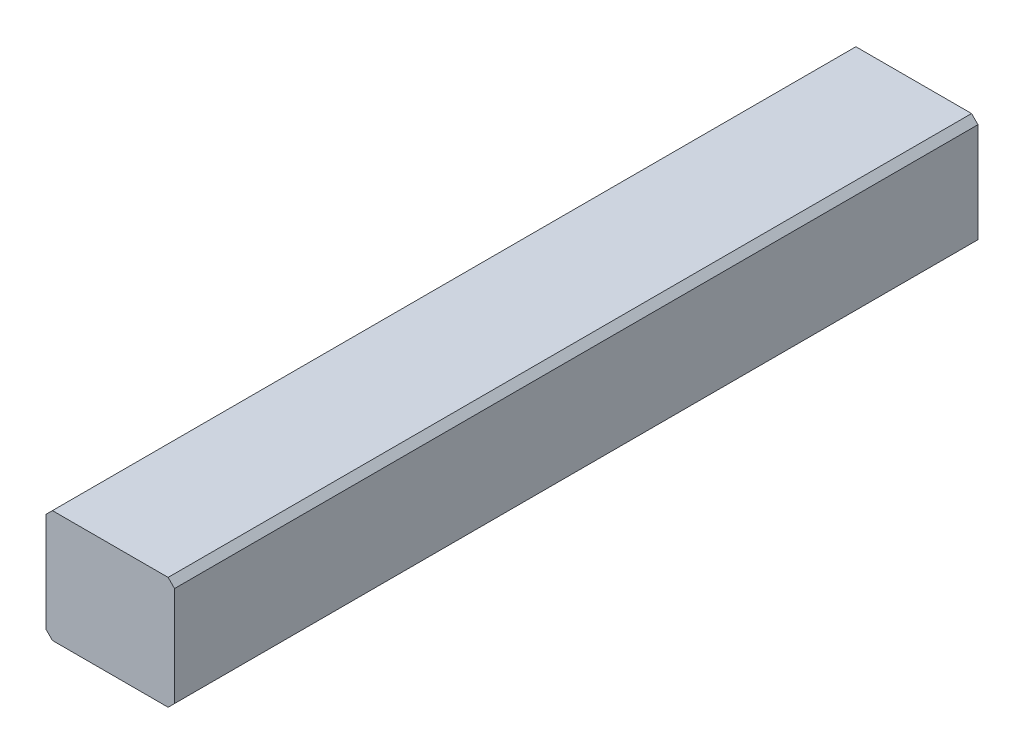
SolidWorks part; units mm, degrees
ref_plane "Front" through (0, 0, 0) normal (0, 0, 1) x (1, 0, 0)
ref_plane "Top" through (0, 0, 0) normal (0, 1, 0) x (1, 0, 0)
ref_plane "Right" through (0, 0, 0) normal (1, 0, 0) x (0, 0, -1)
other "Configuration Table"
sketch "body" plane through (0, 0, 0) normal (0, 0, 1) x (1, 0, 0)
  line L1 (0, 0) -> (8, 0)
  line L2 (0, 0) -> (0, 7)
  line L3 (0, 7) -> (8, 7)
  line L4 (8, 0) -> (8, 7)
  dimension "Thickness" = 7
  dimension "Width" = 8
extrude "Extrude1" add sketch "body" along normal blind 50
chamfer "Chamfer1" distance 0.4 4 edges at (0, 0, 25) (8, 0, 25) (0, 7, 25) (8, 7, 25)
